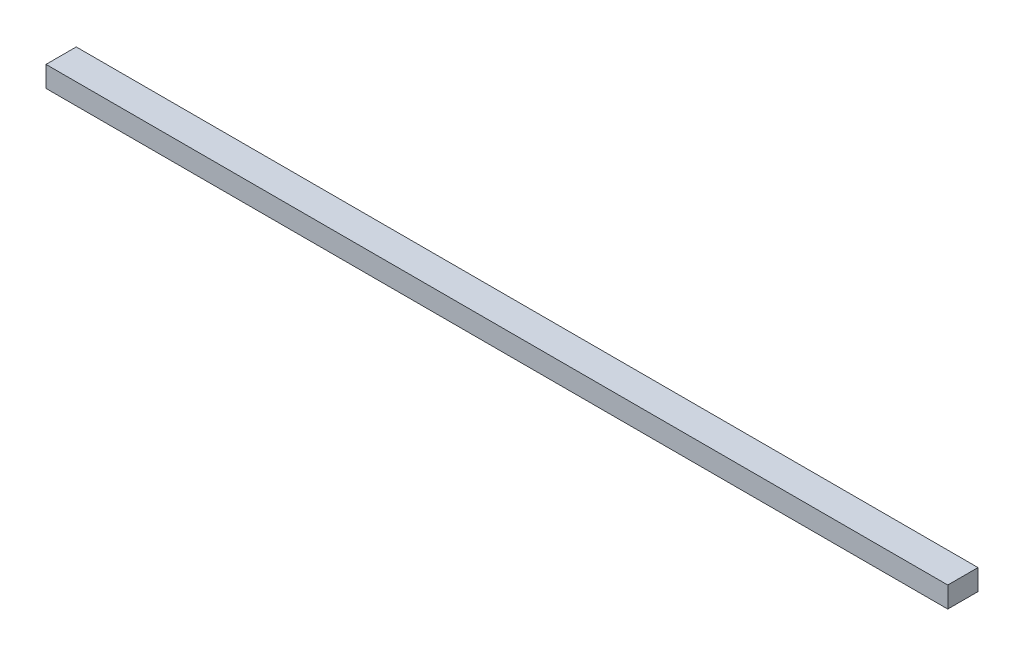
SolidWorks part; units mm, degrees
ref_plane "Front Plane" through (0, 0, 0) normal (0, 0, 1) x (1, 0, 0)
ref_plane "Top Plane" through (0, 0, 0) normal (0, 1, 0) x (1, 0, 0)
ref_plane "Right Plane" through (0, 0, 0) normal (1, 0, 0) x (0, 0, -1)
sketch "Sketch1" plane through (0, 0, 0) normal (0, 1, 0) x (1, 0, 0)
  line L1 (-274.6375, -9.2075) -> (274.6375, -9.2075)
  line L2 (-274.6375, -9.2075) -> (-274.6375, 9.2075)
  line L3 (-274.6375, 9.2075) -> (274.6375, 9.2075)
  line L4 (274.6375, -9.2075) -> (274.6375, 9.2075)
  line L5 (-274.6375, -9.2075) -> (274.6375, 9.2075) construction
  line L6 (-274.6375, 9.2075) -> (274.6375, -9.2075) construction
  point P0 (0, 0)
  dimension "D1" = 18.415
  dimension "D2" = 549.275
extrude "Boss-Extrude1" add sketch "Sketch1" along normal blind 12.7
